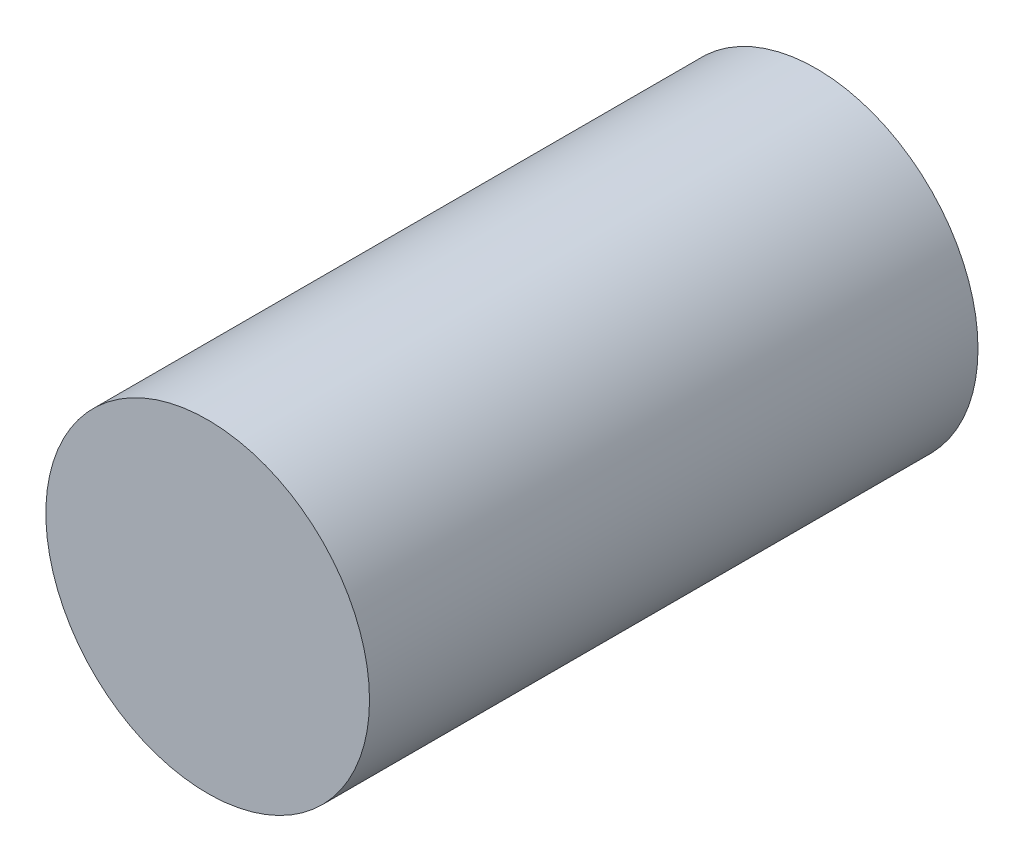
SolidWorks part; units mm, degrees
ref_plane "Front Plane" through (0, 0, 0) normal (0, 0, 1) x (1, 0, 0)
ref_plane "Top Plane" through (0, 0, 0) normal (0, 1, 0) x (1, 0, 0)
ref_plane "Right Plane" through (0, 0, 0) normal (1, 0, 0) x (0, 0, -1)
sketch "Sketch1" plane through (0, 0, 0) normal (0, 0, 1) x (1, 0, 0)
  circle A0 centre (0, 0) radius 37.5
  dimension "D1" = 75
extrude "Boss-Extrude1" add sketch "Sketch1" along normal blind 141
